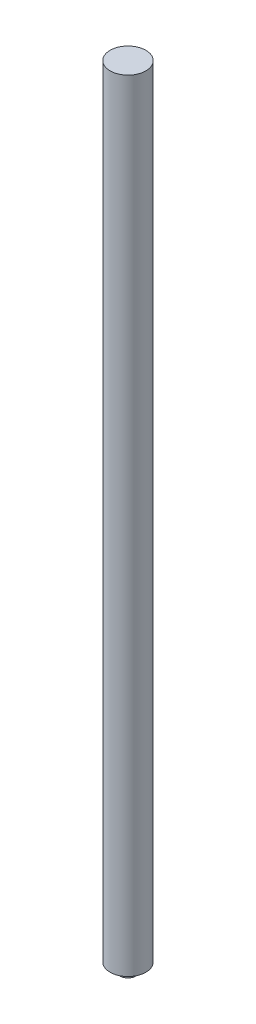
SolidWorks part; units mm, degrees
ref_plane "Front" through (0, 0, 0) normal (0, 0, 1) x (1, 0, 0)
ref_plane "Top" through (0, 0, 0) normal (0, 1, 0) x (1, 0, 0)
ref_plane "Right" through (0, 0, 0) normal (1, 0, 0) x (0, 0, -1)
sketch "Sketch1" plane through (0, 0, 0) normal (0, 0, 1) x (1, 0, 0)
  line L0 (0, 0) -> (5, 0)
  line L1 (5, 0) -> (5, 5)
  line L2 (5, 5) -> (11, 5)
  line L3 (11, 5) -> (11, 486)
  line L4 (11, 486) -> (0, 486)
  line L5 (0, 486) -> (0, 0)
  line L7 (0, 886) -> (5, 886) construction
  line L8 (0, 886) -> (0, 486) construction
  line L9 (0, 486) -> (5, 486)
  line L10 (5, 886) -> (5, 486) construction
  dimension "D1" = 11
  dimension "D2" = 5
  dimension "D3" = 5
  dimension "D4" = 881
  dimension "D5" = 400
  dimension "D6" = 5
revolve "Revolve1" add sketch "Sketch1" angle 360 about L5
